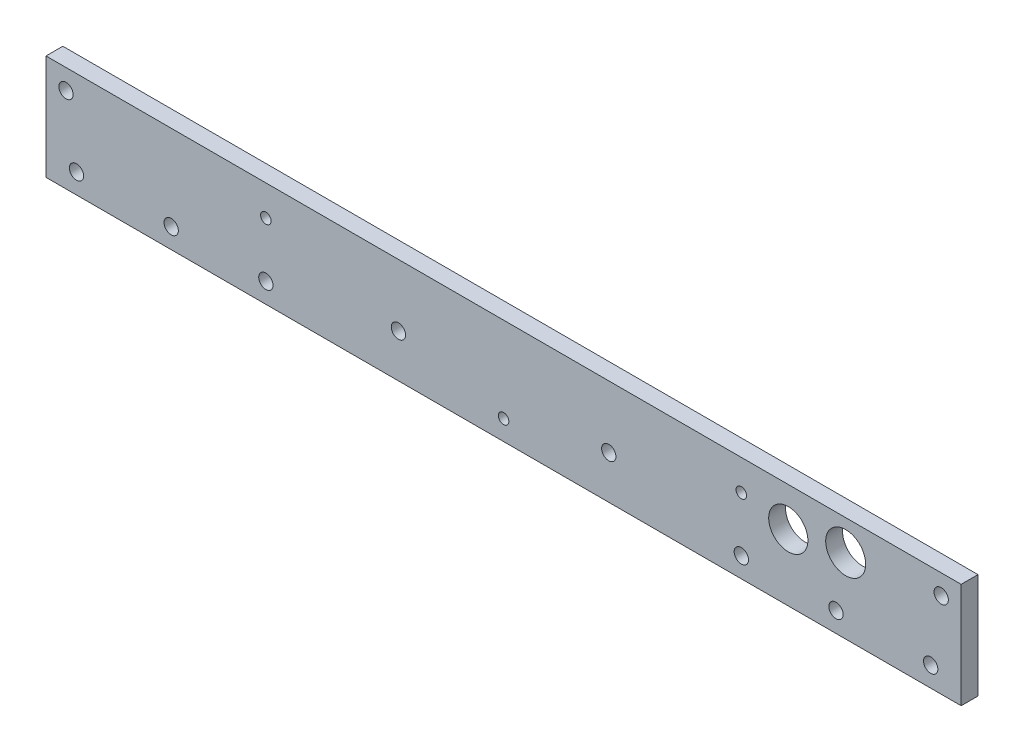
SolidWorks part; units mm, degrees
ref_plane "Ebene1" through (0, 0, 0) normal (0, 0, 1) x (1, 0, 0)
ref_plane "Ebene2" through (0, 0, 0) normal (0, 1, 0) x (1, 0, 0)
ref_plane "Ebene3" through (0, 0, 0) normal (1, 0, 0) x (0, 0, -1)
sketch "Skizze1" plane through (0, 0, 0) normal (0, 0, 1) x (1, 0, 0)
  line L1 (0, 0) -> (435, 0)
  line L2 (0, 0) -> (0, 50)
  line L3 (0, 50) -> (435, 50)
  line L4 (435, 0) -> (435, 50)
  dimension "D1" = 435
  dimension "D2" = 50
extrude "Basis-Linear austragen" add sketch "Skizze1" along normal blind 8
hole_wizard "M6 Befestigung" positions "Skizze29" profile "Skizze28" tap size "M6" standard "DIN"
sketch "Skizze29" plane through (0, 0, 8) normal (0, 0, 1) x (1, 0, 0)
  line L0 (217.5, 50) -> (217.5, 0) construction
  line L1 (435, 50) -> (0, 50) construction
  line L2 (0, 0) -> (435, 0) construction
  point P0 (104.5, 35.5)
  point P1 (217.5, 9.5)
  point P3 (330.5, 35.5)
  dimension "D1" = 226
  dimension "D2" = 35.5
  dimension "D3" = 9.5
sketch "Skizze28" plane through (104.5, 35.5, 8) normal (1, 0, 0) x (0, -1, 0)
  line L0 (0, 0) -> (0, 8)
  line L1 (0, 8) -> (2.5, 8)
  line L2 (2.5, 8) -> (2.5, 0)
  line L5 (2.5, 0) -> (0, 0)
  line L11 (0, -6.35) -> (0, 107.95) construction
  dimension "Bohrerdurchmesser" = 5
  dimension "Bohrungstiefe" = 8
hole_wizard "M8 Scharnier" positions "Skizze27" profile "Skizze26" tap size "M8" standard "DIN"
sketch "Skizze27" plane through (0, 0, 8) normal (0, 0, 1) x (1, 0, 0)
  line L0 (59.5, 9.5) -> (59.5, 0) construction
  line L1 (0, 0) -> (435, 0) construction
  line L2 (375.5, 9.5) -> (375.5, 0) construction
  line L3 (0, 50) -> (0, 0) construction
  point P0 (104.5, 9.5)
  point P1 (59.5, 9.5)
  point P6 (14.5, 9.5)
  point P9 (330.5, 9.5)
  point P12 (375.5, 9.5)
  point P15 (420.5, 9.5)
  dimension "D1" = 316
  dimension "D2" = 90
  dimension "D3" = 90
  dimension "D4" = 9.5
  dimension "D5" = 59.5
sketch "Skizze26" plane through (104.5, 9.5, 8) normal (1, 0, 0) x (0, -1, 0)
  line L0 (0, 0) -> (0, 8)
  line L1 (0, 8) -> (3.4, 8)
  line L2 (3.4, 8) -> (3.4, 0)
  line L5 (3.4, 0) -> (0, 0)
  line L11 (0, -6.35) -> (0, 107.95) construction
  dimension "Bohrerdurchmesser" = 6.8
  dimension "Bohrungstiefe" = 8
hole_wizard "M8 Halter" positions "Skizze23" profile "Skizze22" tap size "M8" standard "DIN"
sketch "Skizze23" plane through (0, 0, 8) normal (0, 0, 1) x (1, 0, 0)
  line L0 (0, 50) -> (0, 0) construction
  line L1 (435, 50) -> (0, 50) construction
  point P0 (9.5, 40.5)
  dimension "D1" = 9.5
  dimension "D2" = 9.5
sketch "Skizze22" plane through (9.5, 40.5, 8) normal (1, 0, 0) x (0, -1, 0)
  line L0 (0, 0) -> (0, 8)
  line L1 (0, 8) -> (3.4, 8)
  line L2 (3.4, 8) -> (3.4, 0)
  line L5 (3.4, 0) -> (0, 0)
  line L11 (0, -6.35) -> (0, 107.95) construction
  dimension "Bohrerdurchmesser" = 6.8
  dimension "Bohrungstiefe" = 8
pattern_linear "Lineares Muster1" count 2 spacing 416 along (1, 0, 0) of "M8 Halter"
hole_wizard "M8 Anschlag" positions "Skizze25" profile "Skizze24" tap size "M8" standard "ISO"
sketch "Skizze25" plane through (0, 0, 8) normal (0, 0, 1) x (1, 0, 0)
  line L0 (0, 0) -> (435, 0) construction
  line L1 (0, 50) -> (0, 0) construction
  point P0 (167.5, 20.5)
  point P1 (267.5, 20.5)
  dimension "D1" = 100
  dimension "D2" = 20.5
  dimension "D3" = 167.5
sketch "Skizze24" plane through (167.5, 20.5, 8) normal (1, 0, 0) x (0, -1, 0)
  line L0 (0, 0) -> (0, 8)
  line L1 (0, 8) -> (3.4, 8)
  line L2 (3.4, 8) -> (3.4, 0)
  line L5 (3.4, 0) -> (0, 0)
  line L11 (0, -6.35) -> (0, 107.95) construction
  dimension "Bohrerdurchmesser" = 6.8
  dimension "Bohrungstiefe" = 8
hole_wizard "G1/2 Gewindebohrung1" positions "Skizze31" profile "Skizze30" tap size "G1/2" standard "ISO"
sketch "Skizze31" plane through (0, 0, 8) normal (0, 0, 1) x (1, 0, 0)
  point P0 (380.1101, 35.5871)
sketch "Skizze30" plane through (380.1101, 35.5871, 8) normal (1, 0, 0) x (0, -1, 0)
  line L0 (0, 0) -> (0, 8)
  line L1 (0, 8) -> (9.5, 8)
  line L2 (9.5, 8) -> (9.5, 0)
  line L5 (9.5, 0) -> (0, 0)
  line L11 (0, -6.35) -> (0, 107.95) construction
  dimension "Bohrerdurchmesser" = 19
  dimension "Bohrungstiefe" = 8
sketch "Skizze32" plane through (0, 0, 8) normal (0, 0, 1) x (1, 0, 0)
  circle A0 centre (352.8262, 31.6016) radius 9.315
  dimension "D1" = 18.63
extrude "Schnitt-Linear austragen1" cut sketch "Skizze32" against normal up to next
